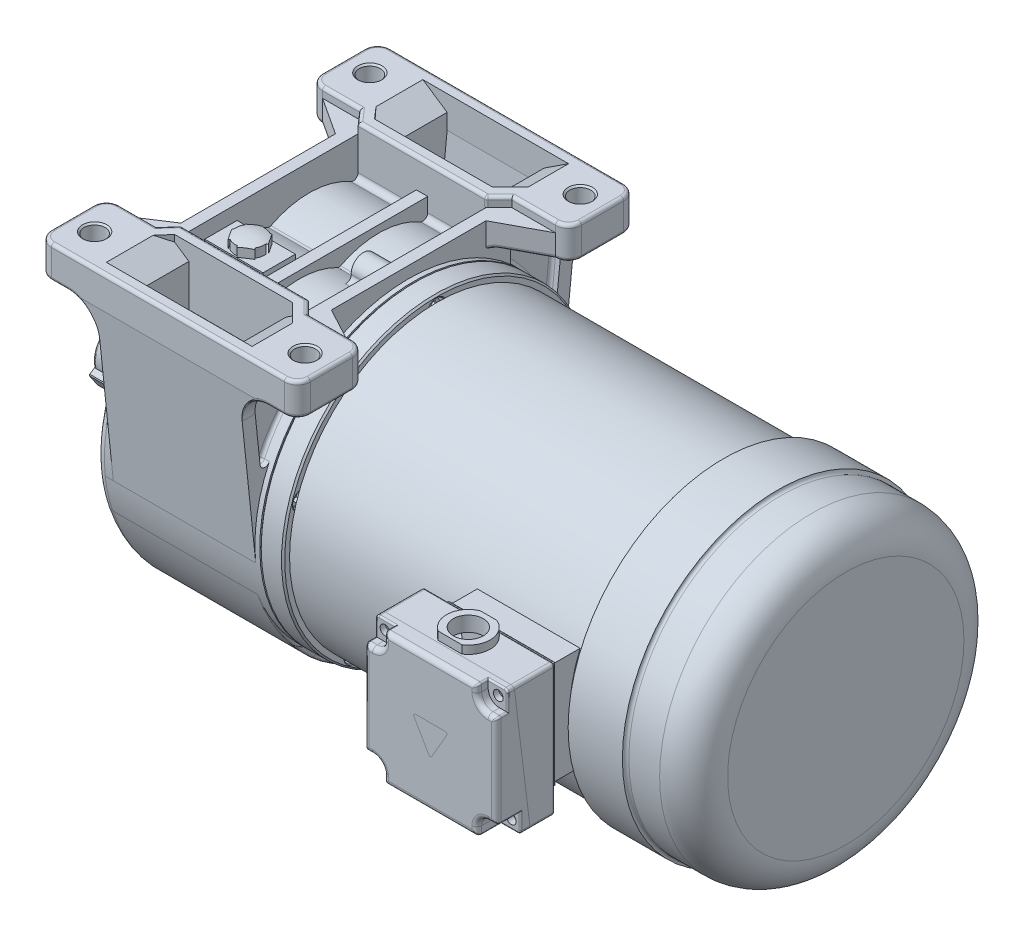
SolidWorks part; units mm, degrees
ref_plane "前视基准面" through (0, 0, 0) normal (0, 0, 1) x (1, 0, 0)
ref_plane "上视基准面" through (0, 0, 0) normal (0, 1, 0) x (1, 0, 0)
ref_plane "右视基准面" through (0, 0, 0) normal (1, 0, 0) x (0, 0, -1)
imported_body "接线盒座-1-surface1"
imported_body "接线盒座-1-surface2"
imported_body "接线盒座-1-surface3"
imported_body "接线盒座-1-surface4"
imported_body "接线盒座-1-surface5"
imported_body "接线盒座-1-surface6"
imported_body "接线盒座-1-surface7"
imported_body "接线盒座-1-surface8"
imported_body "接线盒盖-1-surface1"
imported_body "接线盒盖-1-surface2"
imported_body "接线盒盖-1-surface3"
imported_body "32卧式装配体2-1/32卧式箱体-1-surface1"
imported_body "32卧式装配体2-1/32卧式箱体-1-surface2"
imported_body "32卧式装配体2-1/32卧式箱体-1-surface3"
imported_body "32卧式装配体2-1/32卧式箱体-1-surface4"
imported_body "32卧式装配体2-1/32卧式箱体-1-surface5"
imported_body "32卧式装配体2-1/32卧式箱体-1-surface6"
imported_body "32卧式装配体2-1/32卧式箱体-1-surface7"
imported_body "32卧式装配体2-1/32卧式箱体-1-surface8"
imported_body "32卧式装配体2-1/32卧式箱体-1-surface9"
imported_body "32卧式装配体2-1/32卧式箱体-1-surface10"
imported_body "32卧式装配体2-1/32卧式箱体-1-surface11"
imported_body "32卧式装配体2-1/32卧式箱体-1-surface12"
imported_body "32卧式装配体2-1/32卧式箱体-1-surface13"
imported_body "32卧式装配体2-1/32卧式箱体-1-surface14"
imported_body "32卧式装配体2-1/C10X50-1-surface1"
imported_body "32卧式装配体2-1/透气塞-1-surface1"
sketch "草图1" plane through (-87.5732, 0, 0) normal (1, 0, 0) x (0, 0, -1)
  circle A0 centre (42.3856, -70.4274) radius 91
extrude "凸台-拉伸1" add sketch "草图1" along normal blind 177.1
sketch "草图2" plane through (89.5268, 0, 0) normal (1, 0, 0) x (0, 0, -1)
  circle A0 centre (42.3856, -70.4274) radius 96
extrude "凸台-拉伸2" add sketch "草图2" along normal blind 33.5
sketch "草图3" plane through (123.0268, 0, 0) normal (1, 0, 0) x (0, 0, -1)
  circle A0 centre (42.3856, -70.4274) radius 94
extrude "凸台-拉伸3" add sketch "草图3" along normal blind 42
fillet "圆角1" radius 21 1 edges at (165.0268, -70.4274, -136.3856)
fillet "圆角2" radius 2 1 edges at (123.0268, -70.4274, -136.3856)
